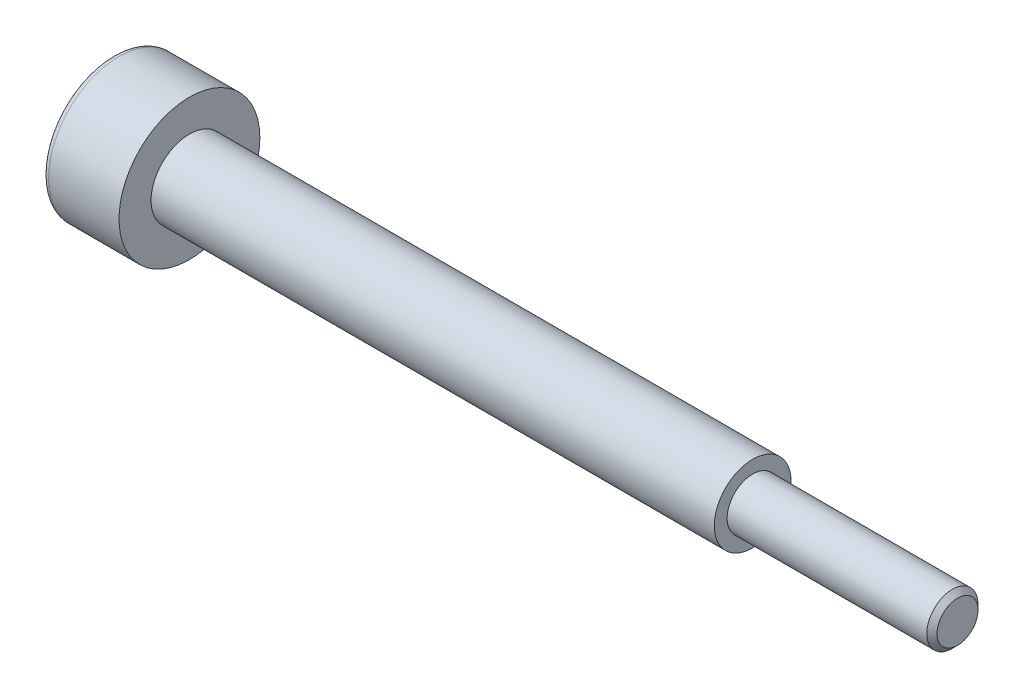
SolidWorks part; units mm, degrees
ref_plane "Plan1" through (0, 0, 0) normal (0, 0, 1) x (1, 0, 0)
ref_plane "Plan2" through (0, 0, 0) normal (0, 1, 0) x (1, 0, 0)
ref_plane "Plan3" through (0, 0, 0) normal (1, 0, 0) x (0, 0, -1)
sketch "Esquisse1" plane through (0, 0, 0) normal (0, 0, 1) x (1, 0, 0)
  line L0 (12.5013, 0) -> (-4.9882, 0) construction
  line L1 (0, 1.5) -> (0, 2.75)
  line L2 (0, 1.5) -> (30, 1.5)
  line L3 (30, 1.5) -> (30, 0)
  line L4 (0, 2.75) -> (-3, 2.75)
  line L5 (-3, 2.75) -> (-3, 0)
  line L6 (30, 0) -> (-3, 0)
  dimension "Ø tige" = 3
  dimension "Ø tete" = 5.5
  dimension "longueur tige" = 30
  dimension "hauteur tete" = 3
revolve "Base-Révolution" add sketch "Esquisse1" angle 360 about L0
chamfer "Chanfrein tige" distance 0.25 angle 45 1 edges at (30, 0, -1.5)
fillet "Congé tete" radius 0.25 1 edges at (-3, 0, -2.75)
sketch "Esquisse2" plane through (-3, 0, 0) normal (-1, 0, 0) x (0, 0, 1)
  line L1 (1.4434, 0) -> (0.7217, 1.25)
  line L2 (0.7217, 1.25) -> (-0.7217, 1.25)
  line L3 (-0.7217, 1.25) -> (-1.4434, 0)
  line L4 (-1.4434, 0) -> (-0.7217, -1.25)
  line L5 (-0.7217, -1.25) -> (0.7217, -1.25)
  line L6 (0.7217, -1.25) -> (1.4434, 0)
  circle A0 centre (0, 0) radius 1.25 construction
  dimension "largeur creux" = 2.5
extrude "Enlèv. mat.-Extru.1" cut sketch "Esquisse2" against normal blind 1.7
sketch "Esquisse3" [suppressed] plane through (-1.3, 0, 0) normal (-1, 0, 0) x (0, 0, 1)
  circle A0 centre (0, 0) radius 0.5
  dimension "D1" = 1
extrude "Enlèv. mat.-Extru.2" [suppressed] cut sketch "Esquisse3" against normal through all
sketch "Esquisse4" plane through (0, 0, 0) normal (0, 0, 1) x (1, 0, 0)
  line L0 (29.75, 0) -> (28.9036, 0) construction
  line L1 (29.75, -1.5) -> (29.75, 1.5) construction
  line L2 (0, 0) -> (29.75, 0) construction
  line L3 (0, -1.5) -> (0, 1.5) construction
  line L4 (29.75, 1.5) -> (0, 1.5) construction
  line L5 (22, 1.5) -> (30, 1.5)
  line L6 (22, 1.5) -> (22, 1)
  line L7 (22, 1) -> (30, 1)
  line L8 (30, 1.5) -> (30, 1)
  line L9 (30, -1.25) -> (30, 1.25) construction
  dimension "D1" = 2
  dimension "D2" = 8
revolve "Enlèvement de matière-Révolution1" cut sketch "Esquisse4" angle 360 about L2
chamfer "Chanfrein1" distance 0.2 angle 45 1 edges at (30, 0, 1)
